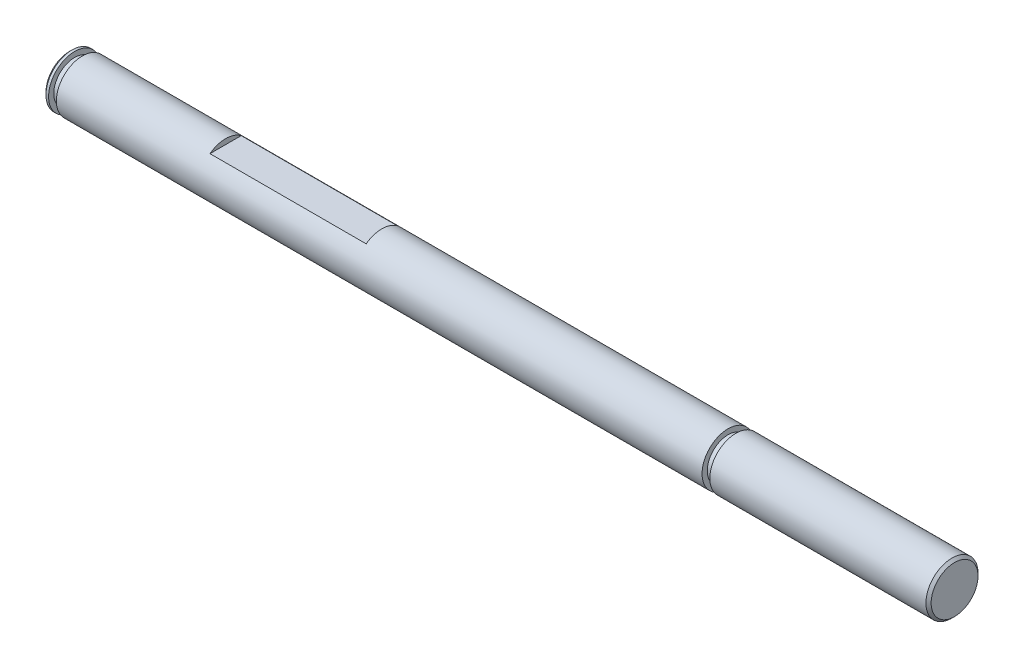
SolidWorks part; units mm, degrees
ref_plane "Front Plane" through (0, 0, 0) normal (0, 0, 1) x (1, 0, 0)
ref_plane "Top Plane" through (0, 0, 0) normal (0, 1, 0) x (1, 0, 0)
ref_plane "Right Plane" through (0, 0, 0) normal (1, 0, 0) x (0, 0, -1)
sketch "Sketch1" plane through (0, 0, 0) normal (1, 0, 0) x (0, 0, -1)
  circle A0 centre (0, 0) radius 2.5
  dimension "D1" = 5
extrude "Boss-Extrude1" add sketch "Sketch1" along normal blind 85
chamfer "Chamfer1" distance 0.25 angle 45 1 edges at (0, 0, -2.5)
sketch "Sketch2" plane through (0, 0, 0) normal (0, 0, 1) x (1, 0, 0)
  line L0 (85, 2.5) -> (0.25, 2.5) construction
  line L1 (0.5, 2.5) -> (1.25, 2.5)
  line L2 (0.5, 2.5) -> (0.5, 2)
  line L3 (0.5, 2) -> (1.25, 2)
  line L4 (1.25, 2.5) -> (1.25, 2)
  line L6 (-0.2476, 0) -> (-1.4539, 0) construction
  line L7 (0, 2.25) -> (0, -2.25) construction
  line L8 (63.25, 2.5) -> (64, 2.5)
  line L9 (63.25, 2.5) -> (63.25, 2)
  line L10 (63.25, 2) -> (64, 2)
  line L11 (64, 2.5) -> (64, 2)
  dimension "D1" = 0.75
  dimension "D2" = 0.5
  dimension "D3" = 1.25
  dimension "D4" = 0.75
  dimension "D5" = 0.5
  dimension "D6" = 62
revolve "Cut-Revolve1" cut sketch "Sketch2" angle 360 about L6
sketch "Sketch4" plane through (0, 0, 0) normal (0, 0, 1) x (1, 0, 0)
  line L0 (63.25, 2.5) -> (1.25, 2.5) construction
  line L1 (15, 2.5) -> (30, 2.5)
  line L2 (15, 2.5) -> (15, 2)
  line L3 (15, 2) -> (30, 2)
  line L4 (30, 2.5) -> (30, 2)
  line L5 (0, 2.25) -> (0, -2.25) construction
  dimension "D1" = 15
  dimension "D2" = 0.5
  dimension "D3" = 15
extrude "Cut-Extrude1" cut sketch "Sketch4" against normal mid plane 10
chamfer "Chamfer2" distance 0.25 angle 45 1 edges at (85, 0, -2.5)
